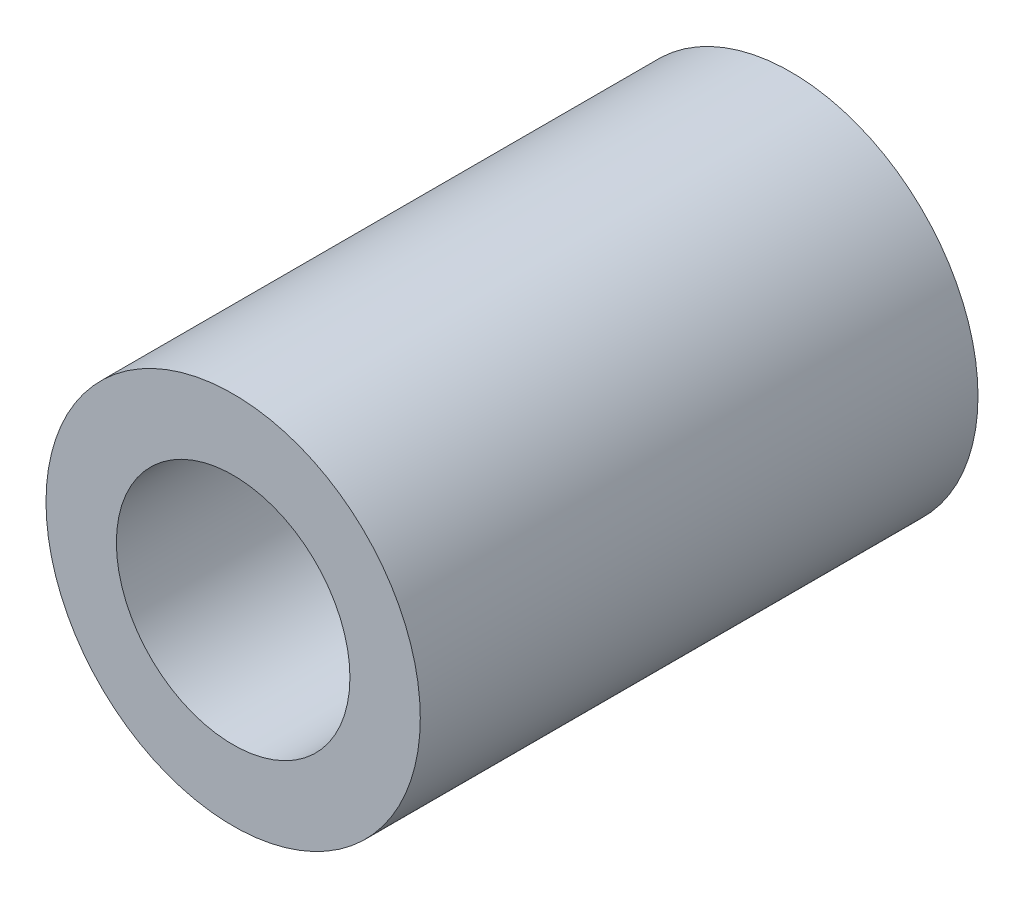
SolidWorks part; units mm, degrees
ref_plane "Front/Back" through (0, 0, 0) normal (0, 0, 1) x (1, 0, 0)
ref_plane "Top/Bottom" through (0, 0, 0) normal (0, 1, 0) x (1, 0, 0)
ref_plane "Right/Left" through (0, 0, 0) normal (1, 0, 0) x (0, 0, -1)
sketch "Sketch1" plane through (0, 0, 0) normal (0, 0, 1) x (1, 0, 0)
  circle A0 centre (0, 0) radius 6.35
  circle A1 centre (0, 0) radius 3.9624
  dimension "D1" = 12.7
  dimension "D2" = 7.9248
extrude "Extrude1" add sketch "Sketch1" along normal mid plane 18.923
